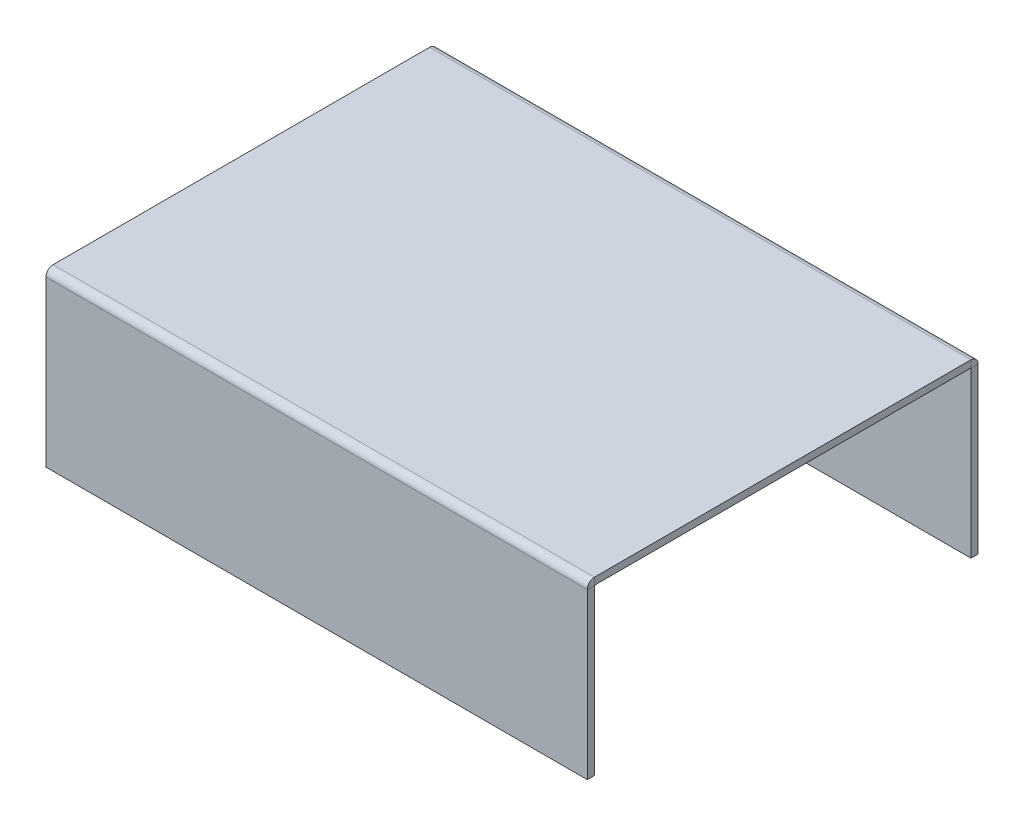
SolidWorks part; units mm, degrees
ref_plane "Front Plane" through (0, 0, 0) normal (0, 0, 1) x (1, 0, 0)
ref_plane "Top Plane" through (0, 0, 0) normal (0, 1, 0) x (1, 0, 0)
ref_plane "Right Plane" through (0, 0, 0) normal (1, 0, 0) x (0, 0, -1)
sketch "Sketch1" plane through (0, 0, 0) normal (0, 1, 0) x (1, 0, 0)
  line L1 (0, 0) -> (115, 0)
  line L2 (0, 0) -> (0, 150)
  line L3 (0, 150) -> (115, 150)
  line L4 (115, 0) -> (115, 150)
  dimension "D1" = 115
  dimension "D2" = 150
sheet metal parameters "Sheet-Metal1" thickness 1.5 parameters "D1"=1
base flange "Base-Flange1" sketch "Sketch1" thickness 1.5 reverse thickness direction yes parameters "D1"=1
sketch "Sketch3" plane through (0, 1.5, 0) normal (0, 1, 0) x (1, 0, 0)
  line L0 (0, 115) -> (115, 115)
  line L1 (0, 150) -> (0, 0) construction
  line L2 (115, 0) -> (115, 150) construction
  line L3 (0, 35) -> (115, 35)
  line L4 (115, 150) -> (0, 150) construction
  line L5 (0, 0) -> (115, 0) construction
  dimension "D1" = 35
  dimension "D2" = 35
sketched bend "Sketched Bend1" parameters "D1"=0.01
bend "SketchBend1" bend radius 0.01 bend angle 90 parameters "D5"=1
bend "SketchBend2" bend radius 0.01 bend angle 90 parameters "D5"=2
flat pattern "Flat-Pattern1"
sketch "Bend-Lines1" plane through (0, 0, 0) normal (0, 1, 0) x (-1, 0, 0)
bend of the flat pattern "Flatten-<SketchBend1>1"
bend of the flat pattern "Flatten-<SketchBend2>1"
